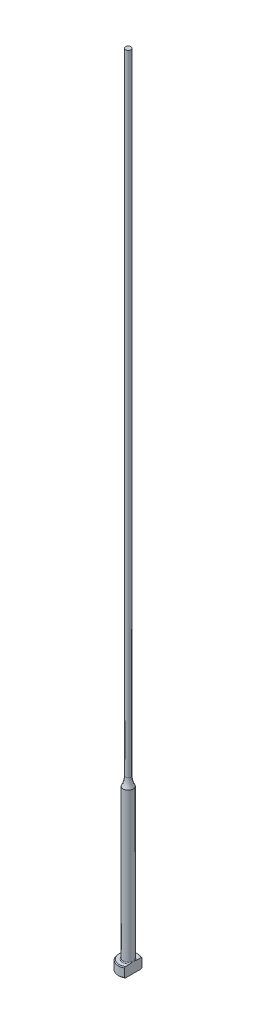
SolidWorks part; units mm, degrees
ref_plane "Front Plane" through (0, 0, 0) normal (0, 0, 1) x (1, 0, 0)
ref_plane "Top Plane" through (0, 0, 0) normal (0, 1, 0) x (1, 0, 0)
ref_plane "Right Plane" through (0, 0, 0) normal (1, 0, 0) x (0, 0, -1)
sketch "Sketch1" plane through (0, 0, 0) normal (0, 0, 1) x (1, 0, 0)
  line L0 (0, 259.9588) -> (0, -15.1925) construction
  line L1 (0, 0) -> (-3.175, 0)
  line L2 (-3.175, 0) -> (-3.175, 3.175)
  line L3 (-3.175, 3.175) -> (-1.5875, 3.175)
  line L4 (-0.8572, 53.7565) -> (-0.8572, 254)
  line L5 (-0.8572, 254) -> (0, 254)
  line L6 (0, 254) -> (0, 0)
  line L7 (-1.5875, 3.175) -> (-1.5875, 50.8)
  arc A0 (-1.5875, 50.8) -> (-0.8572, 53.7565) centre (-7.2072, 53.7565) ccw
  point P13 (-1.5875, 0)
  dimension "D1" = 6.35
  dimension "L" = 254
  dimension "D2" = 3.175
  dimension "H" = 6.35
  dimension "T" = 3.175
  dimension "D" = 1.7145
  dimension "S" = 50.8
revolve "Revolve1" add sketch "Sketch1" angle 360 about L0
chamfer "Chamfer1" distance 0.254 angle 45 2 edges at (0, 3.175, 3.175) (0, 0, 3.175)
fillet "Fillet1" radius 0.254 1 edges at (0, 3.175, 1.5875)
sketch "Sketch2" plane through (0, 0, 0) normal (0, 1, 0) x (1, 0, 0)
  line L0 (1.5875, -2.7496) -> (1.5875, 2.7496)
  circle A0 centre (0, 0) radius 3.175 construction
  arc A2 (1.5875, -2.7496) -> (1.5875, 2.7496) centre (0, 0) ccw
  circle A3 centre (0, 0) radius 3.175 construction
  circle A4 centre (0, 0) radius 1.5875 construction
extrude "Key Head" cut sketch "Sketch2" along normal up to next
